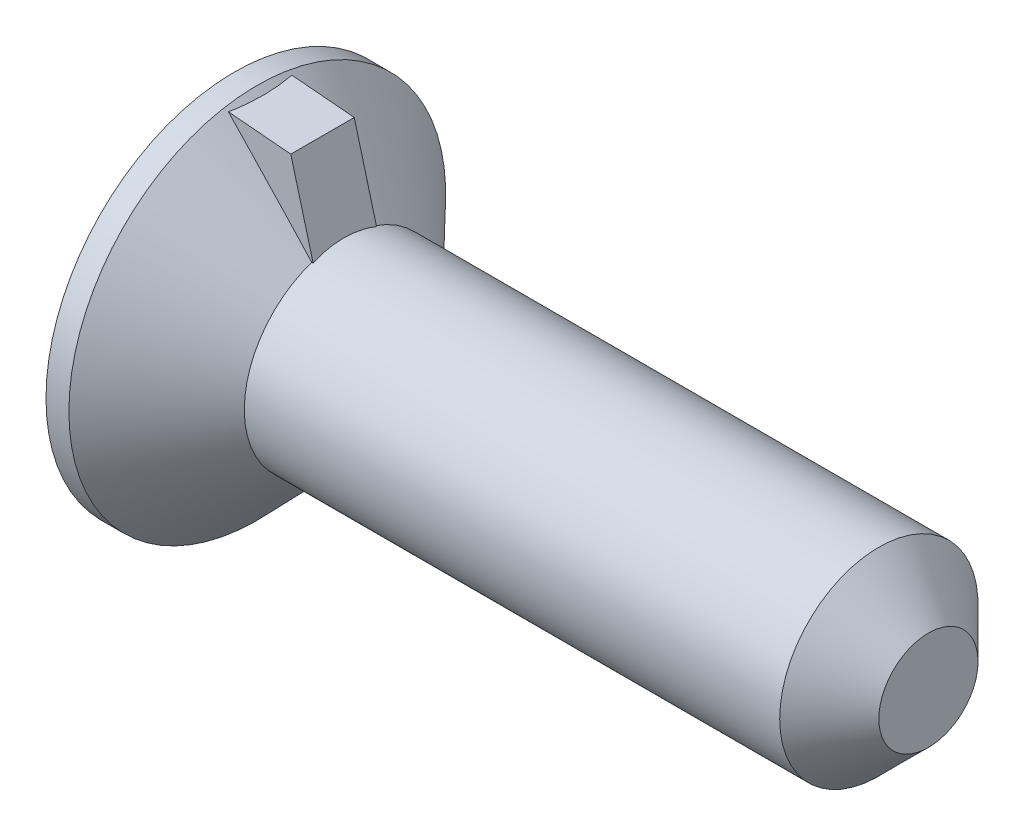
SolidWorks part; units mm, degrees
ref_plane "Front Plane" through (0, 0, 0) normal (0, 0, 1) x (1, 0, 0)
ref_plane "Top Plane" through (0, 0, 0) normal (0, 1, 0) x (1, 0, 0)
ref_plane "Right Plane" through (0, 0, 0) normal (1, 0, 0) x (0, 0, -1)
sketch "BodySke" plane through (0, 0, 0) normal (0, 0, 1) x (1, 0, 0)
  line L0 (0, 0) -> (44.1549, 0) construction
  line L1 (0, 0) -> (0, 9.5)
  line L2 (0, 9.5) -> (1.1544, 9.5)
  line L3 (1.1544, 9.5) -> (5.5, 5)
  line L4 (5.5, 5) -> (32.5, 5)
  line L5 (32.5, 5) -> (35, 2.5)
  line L6 (35, 2.5) -> (35, 0)
  line L7 (35, 0) -> (0, 0)
  line L8 (0, -9.5) -> (1.1544, -9.5) construction
  line L9 (1.1544, -9.5) -> (5.5, -5) construction
  line L10 (5.5, 5) -> (5.5, 0) construction
  line L11 (33.5, 0) -> (33.5, 5) construction
  line L12 (5.5, 5) -> (5.5, 13.4) construction
  line L13 (1.4441, 9.2) -> (4.445, 8.9375) construction
  line L14 (4.445, 8.9375) -> (5.5, 5) construction
  line L15 (1.4441, 9.2) -> (5.5, 9.2) construction
  point P19 (0, 4.172)
  dimension "Head_diameter" = 19
  dimension "D2" = 15
  dimension "Head_Angle" = 92
  dimension "D3" = 5
  dimension "Diameter" = 10
  dimension "Length" = 35
  dimension "Chamfer_Angle" = 45
  dimension "Depth_Chamfer" = 2.5
  dimension "Head_Height" = 5.5
  dimension "Thread_length" = 29.5
  dimension "Advance" = 1.5
  dimension "Nib_Height" = 4.2
  dimension "Thread_minor" = 8.344
revolve "BaseBody" add sketch "BodySke" angle 360 about L0
sketch "NibSke" plane through (0, 0, 0) normal (0, 0, 1) x (1, 0, 0)
  line L0 (4.445, 8.9375) -> (6.8397, 0)
  line L1 (35, 0) -> (0, 0) construction
  line L2 (6.8397, 0) -> (1.1544, 0)
  line L5 (1.1544, 9.2253) -> (4.445, 8.9375)
  line L6 (4.445, 8.9375) -> (5.5, 5) construction
  line L7 (1.4441, 9.2) -> (4.445, 8.9375) construction
  line L8 (1.1544, 9.2253) -> (1.1544, 0)
  line L9 (1.1544, 9.5) -> (1.1544, -9.5) construction
extrude "Nib" add sketch "NibSke" along normal mid plane 3.2
sketch "ThdSchSke" plane through (0, 0, 0) normal (0, 0, 1) x (1, 0, 0)
  line L0 (0, 0) -> (35.8559, 0) construction
  line L1 (0, 9.5) -> (0, -9.5) construction
  line L2 (31, 5.9561) -> (31, 5)
  line L3 (31, 5.9561) -> (31.9561, 5.9561)
  line L4 (31.9561, 5.9561) -> (31.9561, 5)
  line L5 (31.9561, 5) -> (31.478, 4.172)
  line L6 (31.478, 4.172) -> (31, 5)
  dimension "D1" = 1.5
revolve "ThreadSchematic" [suppressed] cut sketch "ThdSchSke" angle 360 about L0
pattern_linear "ThdSchPat" [suppressed]
equation "\"Thread_minor@ThreadCosmetic\" = \"Thread_minor@BodySke\""
equation "\"D1@ThdSchSke\" = \"Advance@BodySke\""
equation "\"Advance@ThdSchPat\" = \"Advance@BodySke\""
equation "\"Teeth_Num@ThdSchPat\" =  int( (  \"Thread_length@BodySke\" - \"Depth_Chamfer@BodySke\" )  / \"Advance@BodySke\" )  - 1"
